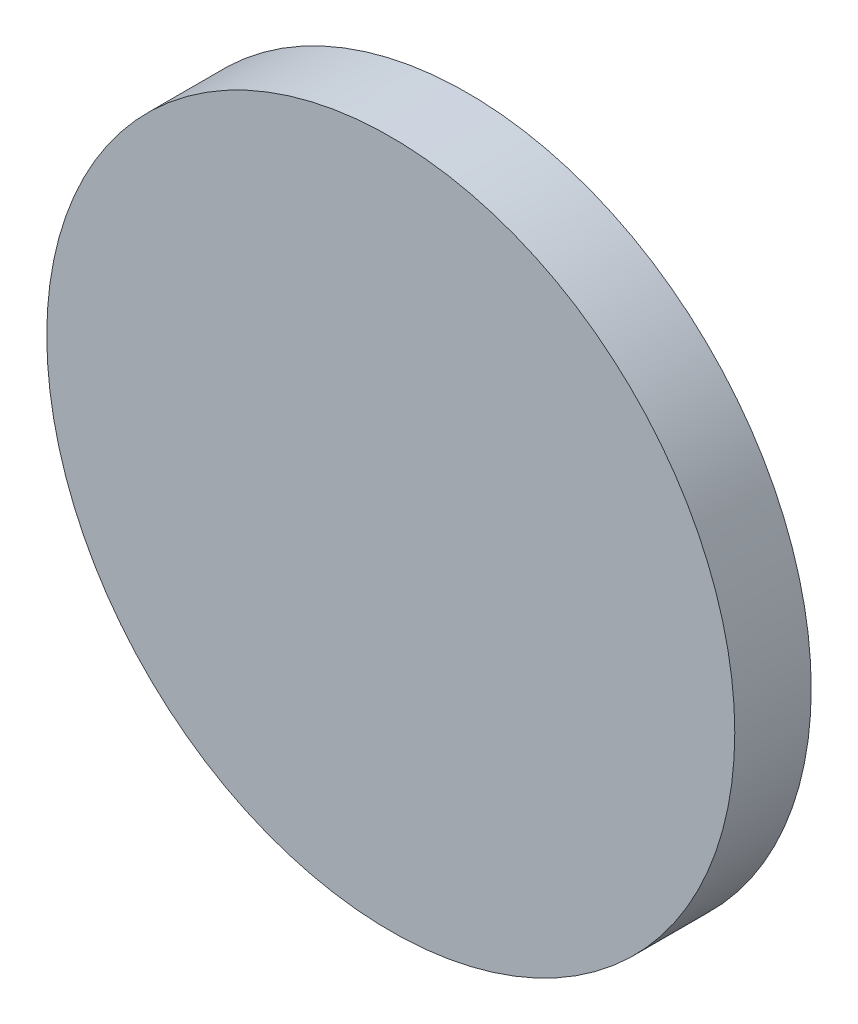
SolidWorks part; units mm, degrees
ref_plane "Plan de face" through (0, 0, 0) normal (0, 0, 1) x (1, 0, 0)
ref_plane "Plan de dessus" through (0, 0, 0) normal (0, 1, 0) x (1, 0, 0)
ref_plane "Plan de droite" through (0, 0, 0) normal (1, 0, 0) x (0, 0, -1)
sketch "Esquisse1" plane through (0, 0, 0) normal (0, 0, 1) x (1, 0, 0)
  circle A0 centre (0, 0) radius 45
  dimension "D1" = 90
extrude "Extrusion1" add sketch "Esquisse1" along normal blind 10
